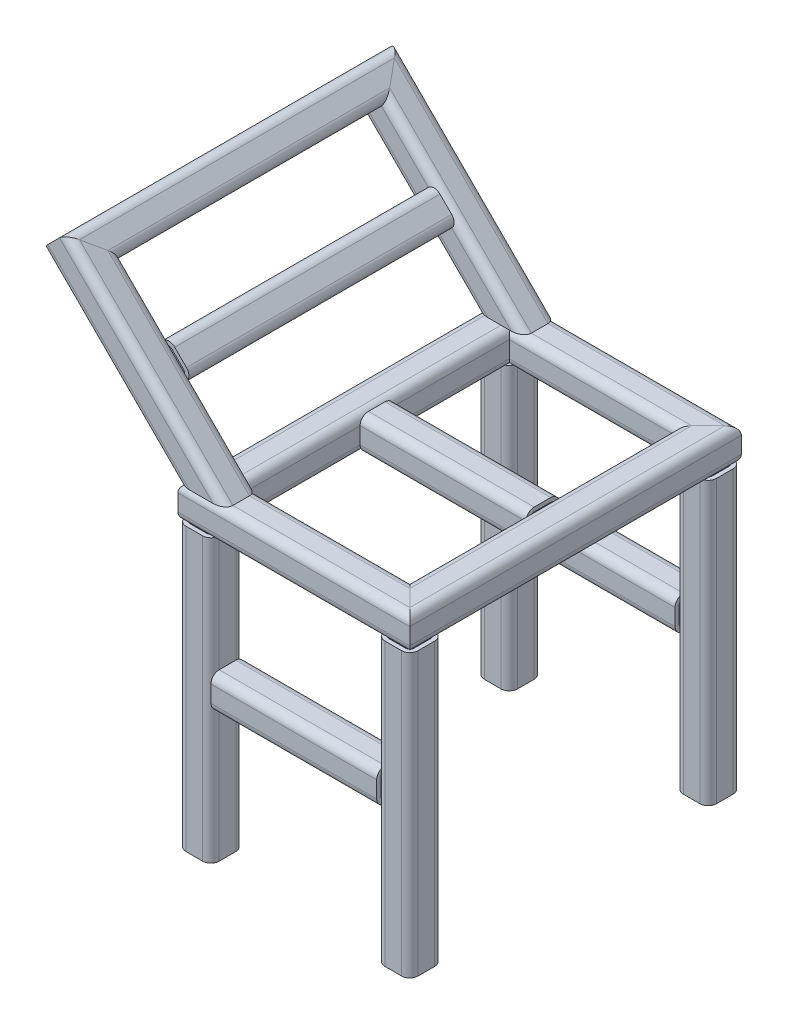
SolidWorks part; units mm, degrees
ref_plane "Front Plane" through (0, 0, 0) normal (0, 0, 1) x (1, 0, 0)
ref_plane "Top Plane" through (0, 0, 0) normal (0, 1, 0) x (1, 0, 0)
ref_plane "Right Plane" through (0, 0, 0) normal (1, 0, 0) x (0, 0, -1)
sketch "Sketch1" plane through (0, 0, 0) normal (0, 1, 0) x (1, 0, 0)
  line L0 (0, -457.2) -> (304.8, -457.2)
  line L1 (0, 0) -> (304.8, 0)
  line L2 (0, 0) -> (0, -457.2)
  line L3 (0, -228.6) -> (304.8, -228.6)
  line L4 (304.8, 0) -> (304.8, -457.2)
  line L5 (152.4, 0) -> (152.4, -228.6)
  line L6 (152.4, -228.6) -> (152.4, -457.2)
  dimension "D1" = 304.8
  dimension "D2" = 457.2
sketch3d "3DSketch1"
  line L0 (0, 0, 0) -> (-215.5261, 215.5261, 0)
  line L1 (-215.5261, 215.5261, 0) -> (-215.5261, 215.5261, 457.2)
  line L2 (-215.5261, 215.5261, 457.2) -> (0, 0, 457.2)
  line L3 (0, 0, 0) -> (0, 0, 457.2) construction
  line L4 (0, 0, 0) -> (304.8, 0, 0) construction
  line L5 (-107.7631, 107.7631, 0) -> (-107.7631, 107.7631, 457.2)
  line L6 (0, 0, 228.6) -> (-215.5261, 215.5261, 228.6)
  dimension "D1" = 304.8
  dimension "D2" = 135
  dimension "D3" = 152.4
sketch "Sketch2" plane through (0, 0, 0) normal (0, 0, 1) x (1, 0, 0)
  line L0 (0, 0) -> (0, -457.2)
  line L1 (304.8, 0) -> (304.8, -457.2)
  line L2 (0, -228.6) -> (304.8, -228.6)
  dimension "D1" = 457.2
ref_plane "Plane1" through (0, 0, 457.2) normal (0, 0, 1) x (1, 0, 0)
sketch "Sketch3" plane through (0, 0, 457.2) normal (0, 0, 1) x (1, 0, 0)
  line L0 (0, 0) -> (0, -457.2)
  line L1 (304.8, 0) -> (304.8, -457.2)
  line L2 (0, -228.6) -> (304.8, -228.6)
  dimension "D1" = 457.2
other "Structural Member1"
ref_plane "Plane5" through (-215.5261, 215.5261, 457.2) normal (0.7071, -0.7071, 0) x (0, 0, -1)
sketch "Sketch111" plane through (-197.5656, 233.4867, 457.2) normal (0.7071, -0.7071, 0) x (0, 0, -1)
  line L0 (-12.7, -19.05) -> (12.7, -19.05)
  line L1 (-19.05, -12.7) -> (-19.05, 12.7)
  line L2 (12.7, 19.05) -> (-12.7, 19.05)
  line L3 (19.05, 12.7) -> (19.05, -12.7)
  line L4 (-12.7, -25.4) -> (12.7, -25.4)
  line L5 (-25.4, -12.7) -> (-25.4, 12.7)
  line L6 (12.7, 25.4) -> (-12.7, 25.4)
  line L7 (25.4, 12.7) -> (25.4, -12.7)
  line L8 (0, 0) -> (19.05, 0) construction
  line L9 (0, 0) -> (0, 19.05) construction
  arc A0 (25.4, 12.7) -> (12.7, 25.4) centre (12.7, 12.7) ccw
  arc A1 (12.7, -25.4) -> (25.4, -12.7) centre (12.7, -12.7) ccw
  arc A2 (-25.4, -12.7) -> (-12.7, -25.4) centre (-12.7, -12.7) ccw
  arc A3 (-12.7, 25.4) -> (-25.4, 12.7) centre (-12.7, 12.7) ccw
  arc A4 (-12.7, 19.05) -> (-19.05, 12.7) centre (-12.7, 12.7) ccw
  arc A5 (19.05, 12.7) -> (12.7, 19.05) centre (12.7, 12.7) ccw
  arc A6 (12.7, -19.05) -> (19.05, -12.7) centre (12.7, -12.7) ccw
  arc A7 (-19.05, -12.7) -> (-12.7, -19.05) centre (-12.7, -12.7) ccw
  point P3 (0, 25.4)
  point P4 (25.4, 0)
  point P5 (0, -25.4)
  point P6 (-25.4, 0)
  point P7 (-25.4, 25.4)
  point P8 (-25.4, -25.4)
  point P33 (0, 0)
  point P35 (25.4, -25.4)
  point P36 (25.4, 25.4)
  point P37 (0, 0)
  dimension "D1" = 12.7
  dimension "Thickness" = 6.35
  dimension "V_leg" = 50.8
other "Structural Member2"
ref_plane "Plane6" through (0, 0, 457.2) normal (1, 0, 0) x (0, 0, -1)
sketch "Sketch15" plane through (0, 0, 457.2) normal (1, 0, 0) x (0, 0, -1)
  line L0 (-12.7, -19.05) -> (12.7, -19.05)
  line L1 (-19.05, -12.7) -> (-19.05, 12.7)
  line L2 (12.7, 19.05) -> (-12.7, 19.05)
  line L3 (19.05, 12.7) -> (19.05, -12.7)
  line L4 (-12.7, -25.4) -> (12.7, -25.4)
  line L5 (-25.4, -12.7) -> (-25.4, 12.7)
  line L6 (12.7, 25.4) -> (-12.7, 25.4)
  line L7 (25.4, 12.7) -> (25.4, -12.7)
  line L8 (0, 0) -> (19.05, 0) construction
  line L9 (0, 0) -> (0, 19.05) construction
  arc A0 (25.4, 12.7) -> (12.7, 25.4) centre (12.7, 12.7) ccw
  arc A1 (12.7, -25.4) -> (25.4, -12.7) centre (12.7, -12.7) ccw
  arc A2 (-25.4, -12.7) -> (-12.7, -25.4) centre (-12.7, -12.7) ccw
  arc A3 (-12.7, 25.4) -> (-25.4, 12.7) centre (-12.7, 12.7) ccw
  arc A4 (-12.7, 19.05) -> (-19.05, 12.7) centre (-12.7, 12.7) ccw
  arc A5 (19.05, 12.7) -> (12.7, 19.05) centre (12.7, 12.7) ccw
  arc A6 (12.7, -19.05) -> (19.05, -12.7) centre (12.7, -12.7) ccw
  arc A7 (-19.05, -12.7) -> (-12.7, -19.05) centre (-12.7, -12.7) ccw
  point P3 (0, 25.4)
  point P4 (25.4, 0)
  point P5 (0, -25.4)
  point P6 (-25.4, 0)
  point P7 (-25.4, 25.4)
  point P8 (-25.4, -25.4)
  point P33 (0, 0)
  point P35 (25.4, -25.4)
  point P36 (25.4, 25.4)
  point P37 (0, 0)
  dimension "D1" = 12.7
  dimension "Thickness" = 6.35
  dimension "V_leg" = 50.8
other "Structural Member4"
ref_plane "Plane8" through (0, 0, 457.2) normal (0, -1, 0) x (1, 0, 0)
sketch "Sketch17" plane through (0, 0, 457.2) normal (0, -1, 0) x (1, 0, 0)
  line L0 (-12.7, -19.05) -> (12.7, -19.05)
  line L1 (-19.05, -12.7) -> (-19.05, 12.7)
  line L2 (12.7, 19.05) -> (-12.7, 19.05)
  line L3 (19.05, 12.7) -> (19.05, -12.7)
  line L4 (-12.7, -25.4) -> (12.7, -25.4)
  line L5 (-25.4, -12.7) -> (-25.4, 12.7)
  line L6 (12.7, 25.4) -> (-12.7, 25.4)
  line L7 (25.4, 12.7) -> (25.4, -12.7)
  line L8 (0, 0) -> (19.05, 0) construction
  line L9 (0, 0) -> (0, 19.05) construction
  arc A0 (25.4, 12.7) -> (12.7, 25.4) centre (12.7, 12.7) ccw
  arc A1 (12.7, -25.4) -> (25.4, -12.7) centre (12.7, -12.7) ccw
  arc A2 (-25.4, -12.7) -> (-12.7, -25.4) centre (-12.7, -12.7) ccw
  arc A3 (-12.7, 25.4) -> (-25.4, 12.7) centre (-12.7, 12.7) ccw
  arc A4 (-12.7, 19.05) -> (-19.05, 12.7) centre (-12.7, 12.7) ccw
  arc A5 (19.05, 12.7) -> (12.7, 19.05) centre (12.7, 12.7) ccw
  arc A6 (12.7, -19.05) -> (19.05, -12.7) centre (12.7, -12.7) ccw
  arc A7 (-19.05, -12.7) -> (-12.7, -19.05) centre (-12.7, -12.7) ccw
  point P3 (0, 25.4)
  point P4 (25.4, 0)
  point P5 (0, -25.4)
  point P6 (-25.4, 0)
  point P7 (-25.4, 25.4)
  point P8 (-25.4, -25.4)
  point P33 (0, 0)
  point P35 (25.4, -25.4)
  point P36 (25.4, 25.4)
  point P37 (0, 0)
  dimension "D1" = 12.7
  dimension "Thickness" = 6.35
  dimension "V_leg" = 50.8
other "Structural Member6"
ref_plane "Plane10" through (0, 0, 0) normal (0, -1, 0) x (1, 0, 0)
sketch "Sketch114" plane through (0, 0, 0) normal (0, -1, 0) x (1, 0, 0)
  line L0 (-12.7, -19.05) -> (12.7, -19.05)
  line L1 (-19.05, -12.7) -> (-19.05, 12.7)
  line L2 (12.7, 19.05) -> (-12.7, 19.05)
  line L3 (19.05, 12.7) -> (19.05, -12.7)
  line L4 (-12.7, -25.4) -> (12.7, -25.4)
  line L5 (-25.4, -12.7) -> (-25.4, 12.7)
  line L6 (12.7, 25.4) -> (-12.7, 25.4)
  line L7 (25.4, 12.7) -> (25.4, -12.7)
  line L8 (0, 0) -> (19.05, 0) construction
  line L9 (0, 0) -> (0, 19.05) construction
  arc A0 (25.4, 12.7) -> (12.7, 25.4) centre (12.7, 12.7) ccw
  arc A1 (12.7, -25.4) -> (25.4, -12.7) centre (12.7, -12.7) ccw
  arc A2 (-25.4, -12.7) -> (-12.7, -25.4) centre (-12.7, -12.7) ccw
  arc A3 (-12.7, 25.4) -> (-25.4, 12.7) centre (-12.7, 12.7) ccw
  arc A4 (-12.7, 19.05) -> (-19.05, 12.7) centre (-12.7, 12.7) ccw
  arc A5 (19.05, 12.7) -> (12.7, 19.05) centre (12.7, 12.7) ccw
  arc A6 (12.7, -19.05) -> (19.05, -12.7) centre (12.7, -12.7) ccw
  arc A7 (-19.05, -12.7) -> (-12.7, -19.05) centre (-12.7, -12.7) ccw
  point P3 (0, 25.4)
  point P4 (25.4, 0)
  point P5 (0, -25.4)
  point P6 (-25.4, 0)
  point P7 (-25.4, 25.4)
  point P8 (-25.4, -25.4)
  point P33 (0, 0)
  point P35 (25.4, -25.4)
  point P36 (25.4, 25.4)
  point P37 (0, 0)
  dimension "D1" = 12.7
  dimension "Thickness" = 6.35
  dimension "V_leg" = 50.8
other "Trim/Extend1"
other "Trim/Extend2"
